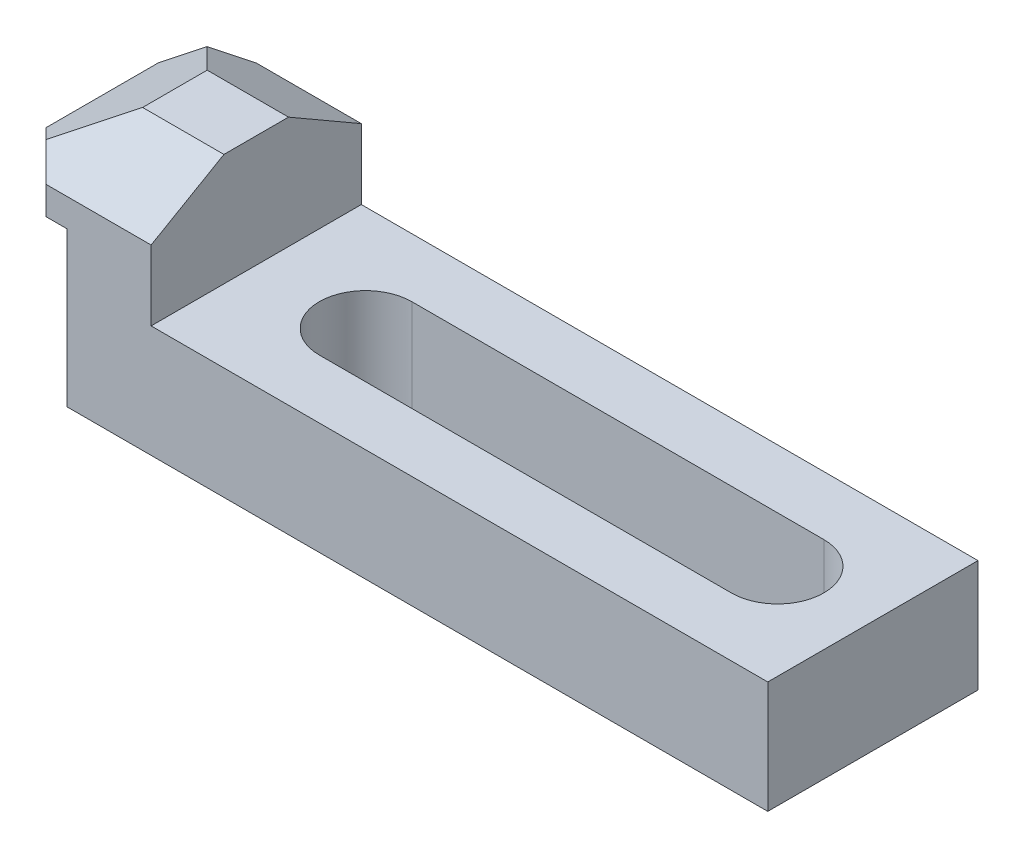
SolidWorks part; units mm, degrees
ref_plane "Front Plane" through (0, 0, 0) normal (0, 0, 1) x (1, 0, 0)
ref_plane "Top Plane" through (0, 0, 0) normal (0, 1, 0) x (1, 0, 0)
ref_plane "Right Plane" through (0, 0, 0) normal (1, 0, 0) x (0, 0, -1)
sketch "Sketch1" plane through (0, 0, 0) normal (0, 0, 1) x (1, 0, 0)
  line L0 (0, 0) -> (5, 0)
  line L1 (5, 0) -> (5, -11)
  line L2 (5, -11) -> (55, -11)
  line L3 (55, -11) -> (55, -3)
  line L4 (55, -3) -> (11, -3)
  line L5 (11, -3) -> (11, 5)
  line L6 (11, 5) -> (0, 5)
  line L7 (0, 5) -> (0, 0)
  dimension "D1" = 5
  dimension "D2" = 11
  dimension "D3" = 55
  dimension "D4" = 11
  dimension "D5" = 8
  dimension "D6" = 16
extrude "Extrude1" add sketch "Sketch1" along normal mid plane 15
chamfer "Chamfer1" distance 3 angle 60 4 edges at (5.5, 5, -7.5) (0, 5, 0) (5.5, 5, 7.5) (11, 5, 0)
sketch "Sketch2" plane through (0, -11, 0) normal (0, -1, 0) x (1, 0, 0)
  line L0 (0, 0) -> (50000, 0) construction
  line L1 (18.8, 3.3) -> (48.2, 3.3)
  line L2 (0, 7.5) -> (3.5, 7.5)
  line L4 (3.5, 7.5) -> (0, 4)
  line L5 (0, 7.5) -> (0, -7.5) construction
  line L6 (0, 4) -> (0, 7.5)
  line L7 (18.8, -3.3) -> (48.2, -3.3)
  line L8 (0, -4) -> (0, -7.5)
  line L9 (3.5, -7.5) -> (0, -4)
  line L10 (0, -7.5) -> (3.5, -7.5)
  arc A0 (18.8, 3.3) -> (18.8, -3.3) centre (18.8, 0) ccw
  arc A1 (48.2, -3.3) -> (48.2, 3.3) centre (48.2, 0) ccw
  point P18 (15.5, 0)
  point P19 (51.5, 0)
  dimension "D1" = 45
  dimension "D2" = 8
  dimension "D3" = 15.5
  dimension "D4" = 6.6
  dimension "D5" = 36
extrude "Extrude2" cut sketch "Sketch2" against normal through all
